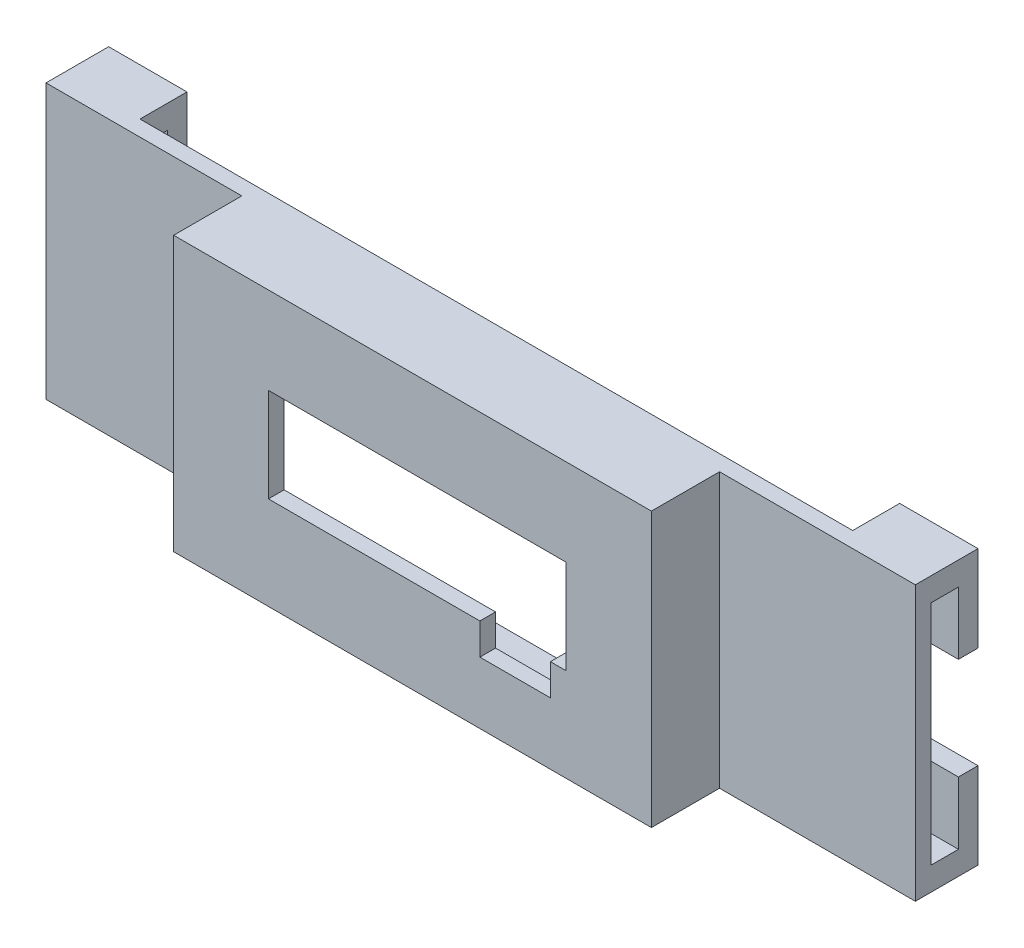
SolidWorks part; units mm, degrees
ref_plane "Alzado" through (0, 0, 0) normal (0, 0, 1) x (1, 0, 0)
ref_plane "Planta" through (0, 0, 0) normal (0, 1, 0) x (1, 0, 0)
ref_plane "Vista lateral" through (0, 0, 0) normal (1, 0, 0) x (0, 0, -1)
sketch "Croquis1" plane through (0, 0, 0) normal (0, 0, 1) x (1, 0, 0)
  line L0 (17.6, -5.6) -> (19.6, -5.6)
  line L1 (-30.5, 17.5) -> (30.5, 17.5)
  line L2 (-30.5, 17.5) -> (-30.5, -17.5)
  line L3 (-30.5, -17.5) -> (30.5, -17.5)
  line L4 (30.5, 17.5) -> (30.5, -17.5)
  line L5 (-18.4, 6.4) -> (19.6, 6.4)
  line L6 (-18.4, 6.4) -> (-18.4, -5.6)
  line L7 (-18.4, -5.6) -> (8.6, -5.6)
  line L8 (19.6, 6.4) -> (19.6, -5.6)
  line L10 (8.6, -5.6) -> (8.6, -9.6)
  line L11 (8.6, -9.6) -> (17.6, -9.6)
  line L12 (17.6, -5.6) -> (17.6, -9.6)
extrude "Saliente-Extruir1" add sketch "Croquis1" along normal blind 2
sketch "Croquis2" plane through (0, 0, 0) normal (0, 0, -1) x (-1, 0, 0)
  line L1 (-30.5, 17.5) -> (30.5, 17.5)
  line L2 (-30.5, 17.5) -> (-30.5, -17.5)
  line L3 (-30.5, -17.5) -> (30.5, -17.5)
  line L4 (30.5, 17.5) -> (30.5, -17.5)
  line L5 (-28.5, 15.5) -> (28.5, 15.5)
  line L6 (-28.5, 15.5) -> (-28.5, -15.5)
  line L7 (-28.5, -15.5) -> (28.5, -15.5)
  line L8 (28.5, 15.5) -> (28.5, -15.5)
extrude "Saliente-Extruir2" add sketch "Croquis2" along normal blind 8.7
sketch "Croquis3" plane through (30.5, 0, 0) normal (1, 0, 0) x (0, 0, -1)
  line L0 (-2, -17.5) -> (8.7, -17.5) construction
  line L1 (8.7, 17.5) -> (6.7, 17.5)
  line L2 (8.7, 17.5) -> (8.7, -17.5)
  line L3 (8.7, -17.5) -> (6.7, -17.5)
  line L4 (6.7, 17.5) -> (6.7, -17.5)
  dimension "D1" = 2
extrude "Saliente-Extruir3" add sketch "Croquis3" along normal blind 25
ref_plane "Plano2" through (0, 0, 0) normal (0, -1, 0) x (-1, 0, 0)
ref_plane "Plano3" through (0, 0, 0) normal (1, 0, 0) x (0, 0, -1)
sketch "Croquis7" plane through (0, 0, -8.7) normal (0, 0, -1) x (-1, 0, 0)
  line L1 (-55.5, 17.5) -> (-45.5, 17.5)
  line L2 (-55.5, 17.5) -> (-55.5, 14.5)
  line L3 (-55.5, 14.5) -> (-45.5, 14.5)
  line L4 (-45.5, 17.5) -> (-45.5, 14.5)
  dimension "D1" = 10
  dimension "D2" = 3
extrude "Saliente-Extruir7" add sketch "Croquis7" along normal blind 6
sketch "Croquis8" plane through (0, 14.5, 0) normal (0, -1, 0) x (-1, 0, 0)
  line L0 (-45.5, 14.7) -> (-45.5, 8.7) construction
  line L1 (-55.5, 14.7) -> (-45.5, 14.7)
  line L2 (-55.5, 14.7) -> (-55.5, 12.2)
  line L3 (-55.5, 12.2) -> (-45.5, 12.2)
  line L4 (-45.5, 14.7) -> (-45.5, 12.2)
  dimension "D1" = 2.5
extrude "Saliente-Extruir8" add sketch "Croquis8" along normal blind 8
mirror "Simetría3" about plane through (0, 0, 0) normal (0, -1, 0) of "Saliente-Extruir7", "Saliente-Extruir8"
mirror "Simetría4" about plane through (0, 0, 0) normal (1, 0, 0) of "Simetría3", "Saliente-Extruir3", "Saliente-Extruir7", "Saliente-Extruir8"
equation "\"LargoOG\"= 51"
equation "\"AnchoOG\"= 25"
equation "\"LargoTapa\"= \"LargoOG\" + 2 * ( \"mmExtra\" )"
equation "\"AnchoTapa\"= \"AnchoOG\" + 2 * ( \"mmExtra\" )"
equation "\"mmExtra\"= 5"
equation "\"D1@Croquis1\"=\"LargoTapa\""
equation "\"D2@Croquis1\"=\"AnchoTapa\""
equation "\"DOled\"= 7.1 + \"mmExtra\""
equation "\"D7@Croquis1\"=\"DOled\""
equation "\"D2Oled\"= 6.1 + \"mmExtra\""
equation "\"DSwitch\"= 7.9 + \"mmExtra\""
equation "\"D8@Croquis1\"=\"D2Oled\""
equation "\"D12@Croquis1\"=\"DSwitch\""
equation "\"MitadLargo\"= \"LargoTapa\" / 2"
equation "\"MitadAncho\"= \"AnchoTapa\" / 2"
equation "\"D9@Croquis1\"=\"MitadLargo\""
equation "\"D10@Croquis1\"=\"MitadAncho\""
equation "\"D1@Croquis2\"=\"Pared\""
equation "\"Pared\"= \"mmExtra\" - 3"
equation "\"D4@Croquis2\"=\"Pared\""
equation "\"D2@Croquis2\"=\"Pared\""
equation "\"D3@Croquis2\"=\"Pared\""
